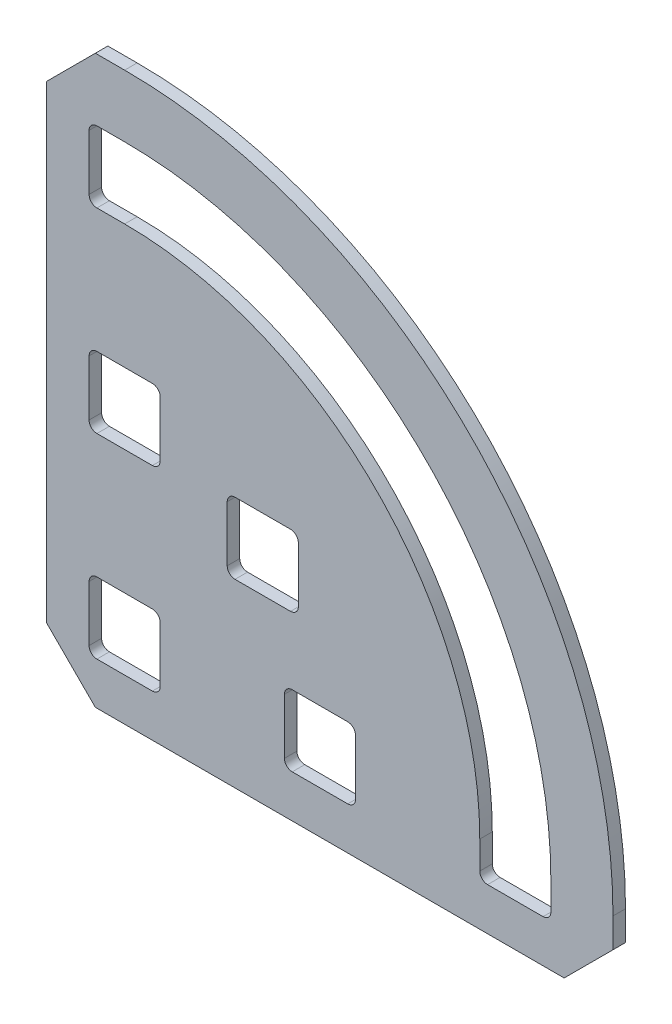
SolidWorks part; units mm, degrees
ref_plane "Front Plane" through (0, 0, 0) normal (0, 0, 1) x (1, 0, 0)
ref_plane "Top Plane" through (0, 0, 0) normal (0, 1, 0) x (1, 0, 0)
ref_plane "Right Plane" through (0, 0, 0) normal (1, 0, 0) x (0, 0, -1)
ref_plane "Plane1" through (0, 0, 0.8128) normal (0, 0, 1) x (1, 0, 0)
sketch "Sketch1" plane through (0, 0, 0.8128) normal (0, 0, 1) x (1, 0, 0)
  line L0 (-14.9666, 23.1461) -> (-14.9666, -7.3339)
  line L1 (-14.9666, -7.3339) -> (-11.7916, -10.5089)
  line L2 (-11.7916, -10.5089) -> (18.6884, -10.5089)
  line L3 (18.6884, -10.5089) -> (21.8634, -7.3339)
  line L4 (21.8634, -7.3339) -> (21.8634, -5.4289)
  line L5 (-9.8866, 26.3211) -> (-11.7916, 26.3211)
  line L6 (-11.7916, 26.3211) -> (-14.9666, 23.1461)
  line L7 (17.3168, -7.7403) -> (13.71, -7.7403)
  line L8 (13.202, -7.2323) -> (13.202, -5.4289)
  line L9 (-9.8866, 17.6597) -> (-11.69, 17.6597)
  line L10 (-12.198, 18.1677) -> (-12.198, 21.7745)
  line L11 (-11.69, 22.2825) -> (-9.8866, 22.2825)
  line L12 (17.8248, -5.4289) -> (17.8248, -7.2323)
  line L13 (5.1248, -3.6255) -> (5.1248, -7.2323)
  line L14 (4.6168, -7.7403) -> (1.01, -7.7403)
  line L15 (0.502, -7.2323) -> (0.502, -3.6255)
  line L16 (1.01, -3.1175) -> (4.6168, -3.1175)
  line L17 (-2.7098, 5.8627) -> (0.897, 5.8627)
  line L18 (1.405, 5.3547) -> (1.405, 1.7479)
  line L19 (0.897, 1.2399) -> (-2.7098, 1.2399)
  line L20 (-3.2178, 1.7479) -> (-3.2178, 5.3547)
  line L21 (-11.69, 9.5825) -> (-8.0832, 9.5825)
  line L22 (-7.5752, 9.0745) -> (-7.5752, 5.4677)
  line L23 (-8.0832, 4.9597) -> (-11.69, 4.9597)
  line L24 (-12.198, 5.4677) -> (-12.198, 9.0745)
  line L25 (-8.0832, -7.7403) -> (-11.69, -7.7403)
  line L26 (-12.198, -7.2323) -> (-12.198, -3.6255)
  line L27 (-11.69, -3.1175) -> (-8.0832, -3.1175)
  line L28 (-7.5752, -3.6255) -> (-7.5752, -7.2323)
  arc A0 (21.8634, -5.4289) -> (-9.8866, 26.3211) centre (-9.8866, -5.4289) ccw
  arc A1 (13.71, -7.7403) -> (13.202, -7.2323) centre (13.71, -7.2323) cw
  arc A2 (13.202, -5.4289) -> (-9.8866, 17.6597) centre (-9.8866, -5.4289) ccw
  arc A3 (-11.69, 17.6597) -> (-12.198, 18.1677) centre (-11.69, 18.1677) cw
  arc A4 (-12.198, 21.7745) -> (-11.69, 22.2825) centre (-11.69, 21.7745) cw
  arc A5 (-9.8866, 22.2825) -> (17.8248, -5.4289) centre (-9.8866, -5.4289) cw
  arc A6 (17.8248, -7.2323) -> (17.3168, -7.7403) centre (17.3168, -7.2323) cw
  arc A7 (4.6168, -3.1175) -> (5.1248, -3.6255) centre (4.6168, -3.6255) cw
  arc A8 (5.1248, -7.2323) -> (4.6168, -7.7403) centre (4.6168, -7.2323) cw
  arc A9 (1.01, -7.7403) -> (0.502, -7.2323) centre (1.01, -7.2323) cw
  arc A10 (0.502, -3.6255) -> (1.01, -3.1175) centre (1.01, -3.6255) cw
  arc A11 (-3.2178, 5.3547) -> (-2.7098, 5.8627) centre (-2.7098, 5.3547) cw
  arc A12 (0.897, 5.8627) -> (1.405, 5.3547) centre (0.897, 5.3547) cw
  arc A13 (1.405, 1.7479) -> (0.897, 1.2399) centre (0.897, 1.7479) cw
  arc A14 (-2.7098, 1.2399) -> (-3.2178, 1.7479) centre (-2.7098, 1.7479) cw
  arc A15 (-12.198, 9.0745) -> (-11.69, 9.5825) centre (-11.69, 9.0745) cw
  arc A16 (-8.0832, 9.5825) -> (-7.5752, 9.0745) centre (-8.0832, 9.0745) cw
  arc A17 (-7.5752, 5.4677) -> (-8.0832, 4.9597) centre (-8.0832, 5.4677) cw
  arc A18 (-11.69, 4.9597) -> (-12.198, 5.4677) centre (-11.69, 5.4677) cw
  arc A19 (-7.5752, -7.2323) -> (-8.0832, -7.7403) centre (-8.0832, -7.2323) cw
  arc A20 (-11.69, -7.7403) -> (-12.198, -7.2323) centre (-11.69, -7.2323) cw
  arc A21 (-12.198, -3.6255) -> (-11.69, -3.1175) centre (-11.69, -3.6255) cw
  arc A22 (-8.0832, -3.1175) -> (-7.5752, -3.6255) centre (-8.0832, -3.6255) cw
extrude "Boss-Extrude1" add sketch "Sketch1" against normal blind 0.8128
